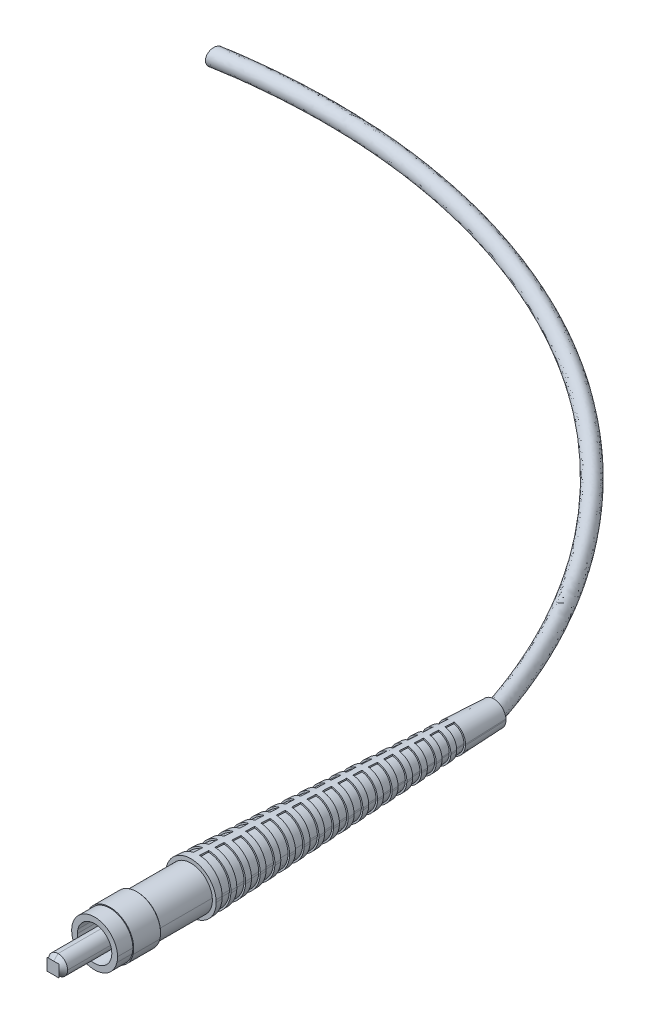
SolidWorks part; units mm, degrees
ref_plane "前视基准面" through (0, 0, 0) normal (0, 0, 1) x (1, 0, 0)
ref_plane "上视基准面" through (0, 0, 0) normal (0, 1, 0) x (1, 0, 0)
ref_plane "右视基准面" through (0, 0, 0) normal (1, 0, 0) x (0, 0, -1)
imported_body "NONE_12-1-surface1"
imported_body "NONE_1_1-1-surface1"
imported_body "NONE_2_1-1-surface1"
imported_body "NONE_4_1-1-surface1"
sketch3d "3D草图1"
  line L0 (0, -1.5875, -0.762) -> (0, -1.5875, -103.5038) construction
  line L1 (0, -1.5875, -40.762) -> (-46.0644, -1.5875, -40.762) construction
  arc A0 (0, -1.5875, -40.762) -> (-118.3448, -1.5875, -139.0649) centre (-100, -1.5875, -40.762) ccw
  point P6 (-100, 98.4125, -40.762)
  dimension "D1" = 40
  dimension "D2" = 100
sketch "草图1" plane through (0, 0, -73.1214) normal (0, 0, -1) x (-1, 0, 0)
  circle A0 centre (0, 0) radius 1.397
sweep "扫描1" add profiles "草图1" path "3D草图1"
